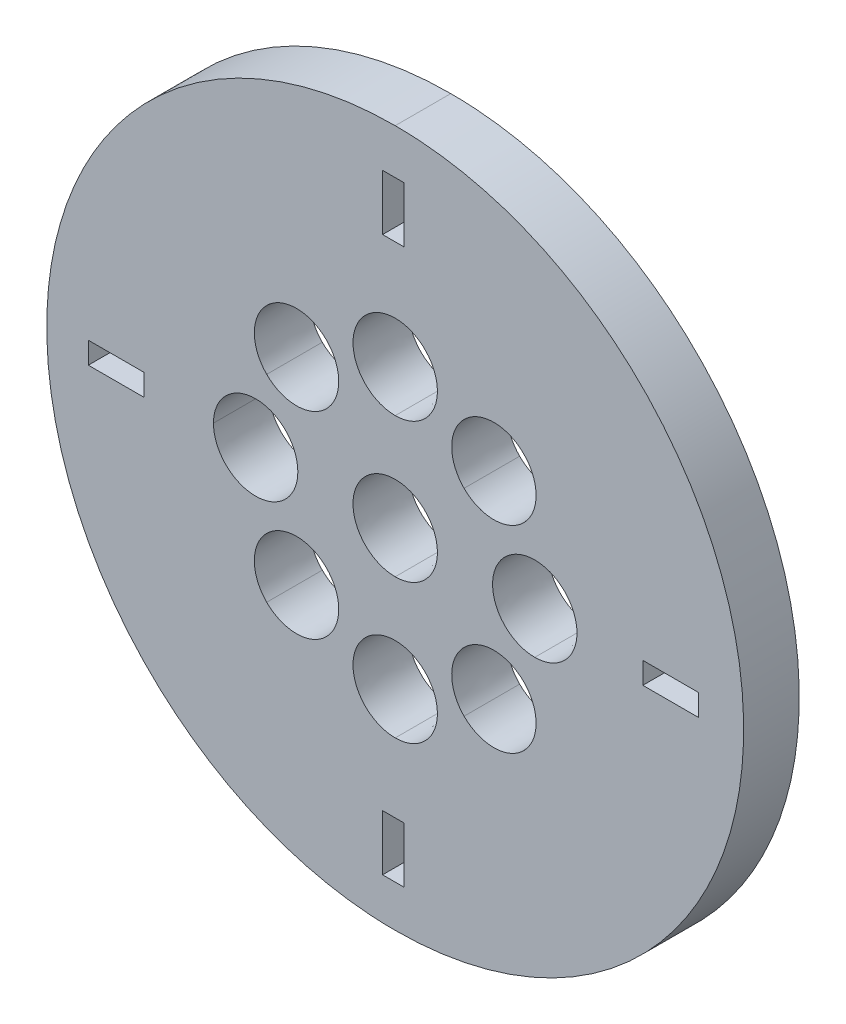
SolidWorks part; units mm, degrees
ref_plane "Alzado" through (0, 0, 0) normal (0, 0, 1) x (1, 0, 0)
ref_plane "Planta" through (0, 0, 0) normal (0, 1, 0) x (1, 0, 0)
ref_plane "Vista lateral" through (0, 0, 0) normal (1, 0, 0) x (0, 0, -1)
sketch "Croquis2" plane through (0, 0, 0) normal (0, 0, 1) x (1, 0, 0)
sketch_block_instance "F1 CAR CUT corte-1"
sketch_block "Bloque1"
extrude "Saliente-Extruir1" add sketch "Croquis2" along normal blind 3
delete or keep bodies "Sólido-Eliminar/Conservar 27" type delete bodies bodies 109 105 110 106 111 107
delete or keep bodies "Sólido-Eliminar/Conservar 30" type delete bodies bodies 108 104 113 114 103 112
delete or keep bodies "Sólido-Eliminar/Conservar 32" type delete bodies bodies 101
